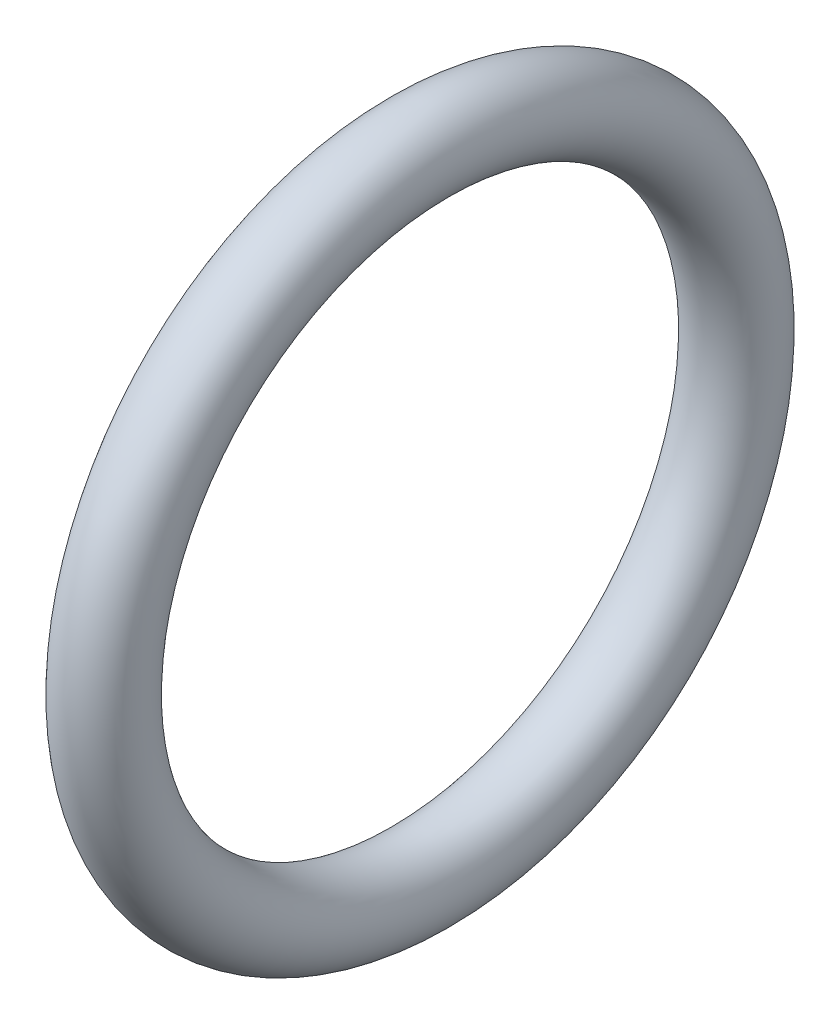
SolidWorks part; units mm, degrees
ref_plane "face" through (0, 0, 0) normal (0, 0, 1) x (1, 0, 0)
ref_plane "dessus" through (0, 0, 0) normal (0, 1, 0) x (1, 0, 0)
ref_plane "droite" through (0, 0, 0) normal (1, 0, 0) x (0, 0, -1)
sketch "Esquisse2" plane through (0, 0, 0) normal (0, 0, 1) x (1, 0, 0)
  line L0 (25.9, 4.32) -> (24.58, 3) construction
  line L1 (26.1, 6) -> (26.1, -6) construction
  line L2 (26.2, 3) -> (17.5, 3) construction
  line L3 (24.1292, 0) -> (28.7261, 0) construction
  line L4 (17.5, 0) -> (24.1292, 0) construction
  circle A0 centre (25.6548, 3.4452) radius 0.4452
  dimension "D1" = 0.8904
revolve "Base-Révolution" add sketch "Esquisse2" angle 360 about L3
